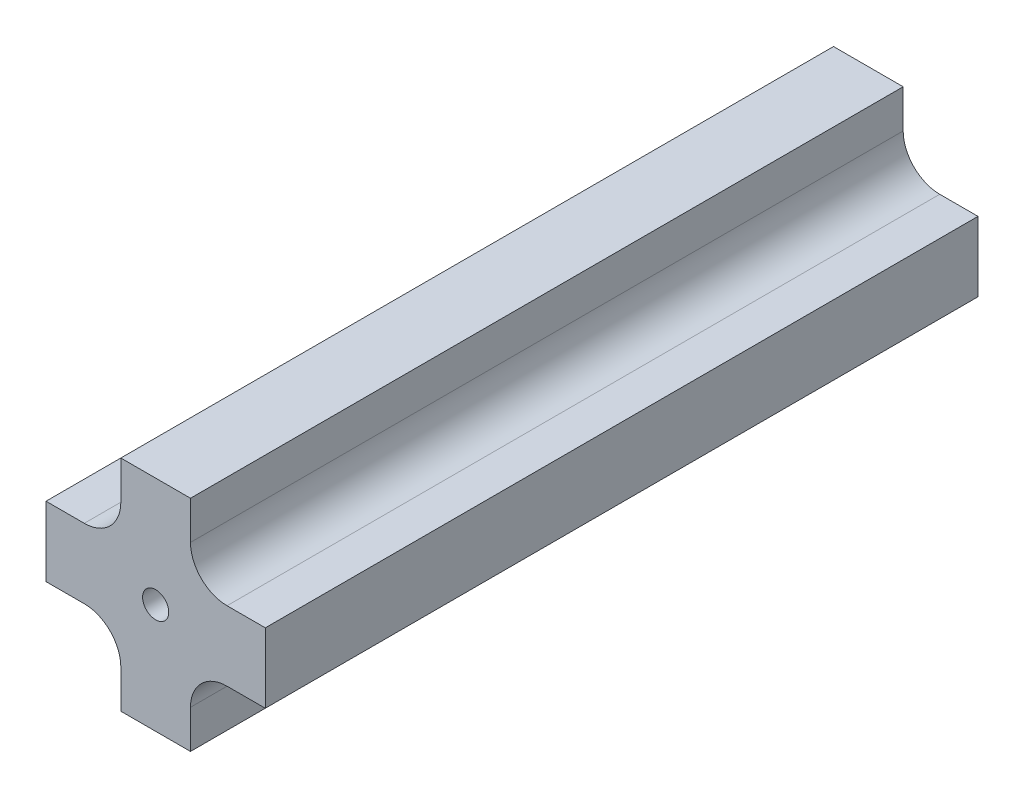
SolidWorks part; units mm, degrees
ref_plane "Front Plane" through (0, 0, 0) normal (0, 0, 1) x (1, 0, 0)
ref_plane "Top Plane" through (0, 0, 0) normal (0, 1, 0) x (1, 0, 0)
ref_plane "Right Plane" through (0, 0, 0) normal (1, 0, 0) x (0, 0, -1)
sketch "Sketch1" plane through (0, 0, 0) normal (0, 0, 1) x (1, 0, 0)
  line L24 (26.0427, -12.7069) -> (40.005, -12.7069)
  line L25 (40.005, -12.7069) -> (40.005, 12.7069)
  line L26 (40.005, 12.7069) -> (26.0427, 12.7069)
  line L27 (12.7069, 26.0427) -> (12.7069, 40.005)
  line L28 (12.7069, 40.005) -> (-12.7069, 40.005)
  line L29 (-12.7069, 40.005) -> (-12.7069, 26.0427)
  line L30 (-26.0427, 12.7069) -> (-40.005, 12.7069)
  line L31 (-40.005, 12.7069) -> (-40.005, -12.7069)
  line L32 (-40.005, -12.7069) -> (-26.0427, -12.7069)
  line L33 (-12.7069, -26.0427) -> (-12.7069, -40.005)
  line L34 (-12.7069, -40.005) -> (12.7069, -40.005)
  line L35 (12.7069, -40.005) -> (12.7069, -26.0427)
  circle A1 centre (0, 0) radius 4.7625
  arc A8 (12.7069, 26.0427) -> (26.0427, 12.7069) centre (26.0427, 26.0427) ccw
  arc A9 (-26.0427, 12.7069) -> (-12.7069, 26.0427) centre (-26.0427, 26.0427) ccw
  arc A10 (-12.7069, -26.0427) -> (-26.0427, -12.7069) centre (-26.0427, -26.0427) ccw
  arc A11 (26.0427, -12.7069) -> (12.7069, -26.0427) centre (26.0427, -26.0427) ccw
extrude "Extrude1" add sketch "Sketch1" along normal blind 260
